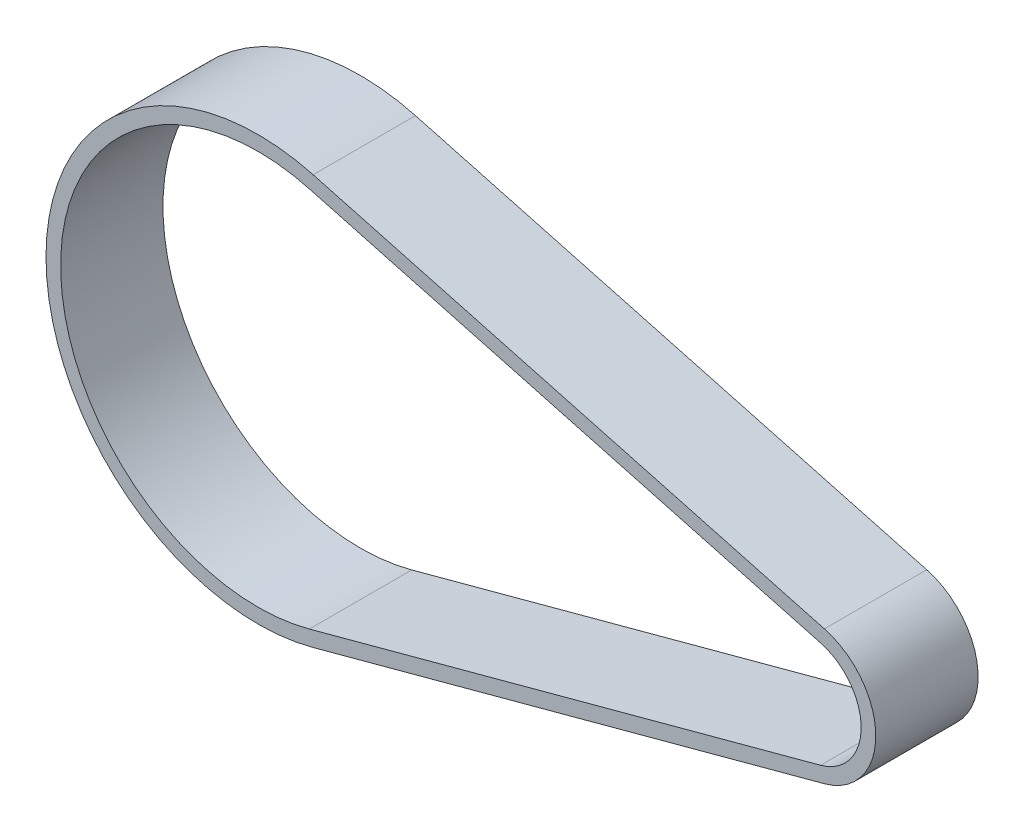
SolidWorks part; units mm, degrees
ref_plane "Plan de face" through (0, 0, 0) normal (0, 0, 1) x (1, 0, 0)
ref_plane "Plan de dessus" through (0, 0, 0) normal (0, 1, 0) x (1, 0, 0)
ref_plane "Plan de droite" through (0, 0, 0) normal (1, 0, 0) x (0, 0, -1)
sketch "Esquisse1" plane through (0, 0, 0) normal (0, 0, 1) x (1, 0, 0)
  line L0 (-46.3514, 0) -> (164.0596, 0) construction
  line L1 (0, -30.4944) -> (0, 38.1179) construction
  line L2 (75, -18.6016) -> (75, 20.7362) construction
  line L3 (7.28, 27.037) -> (77.21, 8.2077)
  line L4 (7.28, -27.037) -> (77.21, -8.2077)
  arc A0 (77.21, -8.2077) -> (77.21, 8.2077) centre (75, 0) ccw
  arc A1 (7.28, 27.037) -> (7.28, -27.037) centre (0, 0) ccw
  dimension "D2" = 17
  dimension "D3" = 56
  dimension "D1" = 75
extrude "Extru.-Mince1" add sketch "Esquisse1" along normal blind 14 thin
